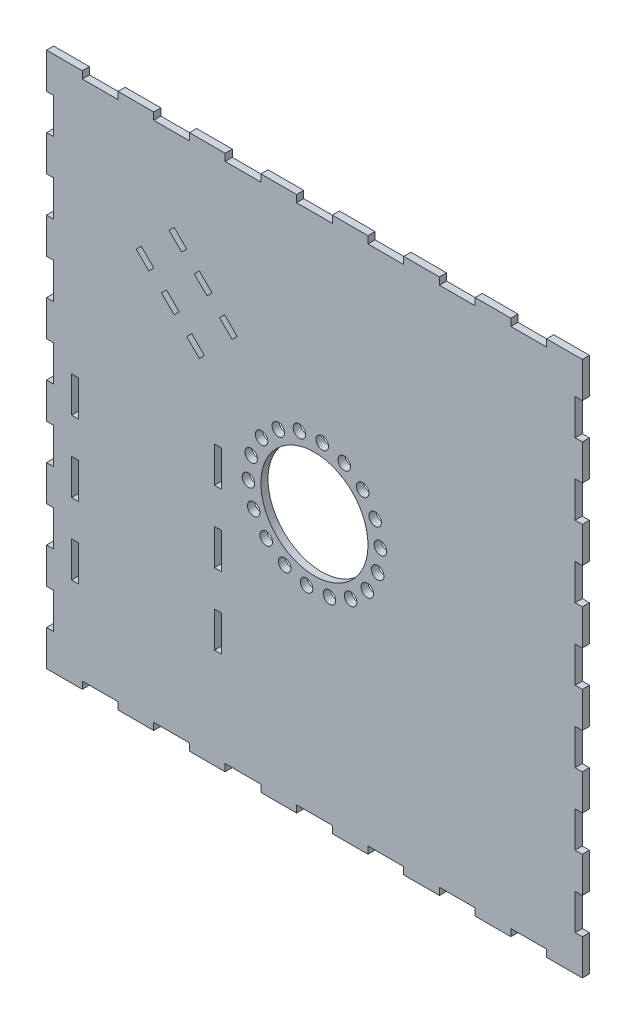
SolidWorks part; units mm, degrees
ref_plane "Front Plane" through (0, 0, 0) normal (0, 0, 1) x (1, 0, 0)
ref_plane "Top Plane" through (0, 0, 0) normal (0, 1, 0) x (1, 0, 0)
ref_plane "Right Plane" through (0, 0, 0) normal (1, 0, 0) x (0, 0, -1)
sketch "Sketch1" plane through (0, 0, 0) normal (0, 0, 1) x (1, 0, 0)
  line L1 (-75, -75) -> (75, -75)
  line L2 (-75, -75) -> (-75, 75)
  line L3 (-75, 75) -> (75, 75)
  line L4 (75, -75) -> (75, 75)
extrude "Boss-Extrude1" add sketch "Sketch1" against normal blind 2
other "Cavity1"
other "sideTop<2>@body1"
other "sideTop<1>@body1"
other "sideTop<3>@body1"
other "sideTop<4>@body1"
sketch "Sketch2" plane through (0, 0, -2) normal (0, 0, -1) x (-1, 0, 0)
  line L0 (75, 75) -> (-75, -75) construction
  line L1 (-75, 75) -> (75, -75) construction
  circle A1 centre (0, 0) radius 42.5 construction
  dimension "D1" = 85
sketch "Sketch3" plane through (0, 0, 0) normal (0, 0, 1) x (1, 0, 0)
  line L116 (-55, 75) -> (-55, 73)
  line L118 (-55, 75) -> (-55, 73)
  line L119 (-65, 75) -> (-75, 75)
  line L120 (-75, 75) -> (-75, 65)
  line L122 (-55, 73) -> (-65, 73)
  line L124 (-55, 73) -> (-65, 73)
  line L126 (-65, 73) -> (-65, 75)
  line L128 (-65, 73) -> (-65, 75)
  line L130 (-75, 65) -> (-73, 65)
  line L132 (-75, 65) -> (-73, 65)
  line L134 (-73, 65) -> (-73, 55)
  line L136 (-73, 65) -> (-73, 55)
  line L138 (-73, 55) -> (-75, 55)
  line L140 (-73, 55) -> (-75, 55)
  line L142 (-75, 55) -> (-75, 45)
  line L144 (-75, 55) -> (-75, 45)
  line L146 (-75, 45) -> (-73, 45)
  line L148 (-75, 45) -> (-73, 45)
  line L149 (-75, -75) -> (-65, -75)
  line L151 (-73, 45) -> (-73, 35)
  line L153 (-73, 45) -> (-73, 35)
  line L155 (-73, 35) -> (-75, 35)
  line L157 (-73, 35) -> (-75, 35)
  line L159 (-75, 35) -> (-75, 25)
  line L161 (-75, 35) -> (-75, 25)
  line L163 (-75, 25) -> (-73, 25)
  line L165 (-75, 25) -> (-73, 25)
  line L167 (-73, 25) -> (-73, 15)
  line L169 (-73, 25) -> (-73, 15)
  line L171 (-73, 15) -> (-75, 15)
  line L173 (-73, 15) -> (-75, 15)
  line L175 (-75, 15) -> (-75, 5)
  line L177 (-75, 15) -> (-75, 5)
  line L178 (75, -75) -> (75, -65)
  line L180 (-75, 5) -> (-73, 5)
  line L182 (-75, 5) -> (-73, 5)
  line L184 (-73, 5) -> (-73, -5)
  line L186 (-73, 5) -> (-73, -5)
  line L188 (-73, -5) -> (-75, -5)
  line L190 (-73, -5) -> (-75, -5)
  line L192 (-75, -5) -> (-75, -15)
  line L194 (-75, -5) -> (-75, -15)
  line L196 (-75, -15) -> (-73, -15)
  line L198 (-75, -15) -> (-73, -15)
  line L200 (-73, -15) -> (-73, -25)
  line L202 (-73, -15) -> (-73, -25)
  line L204 (-73, -25) -> (-75, -25)
  line L206 (-73, -25) -> (-75, -25)
  line L208 (-75, -25) -> (-75, -35)
  line L210 (-75, -25) -> (-75, -35)
  line L212 (-75, -35) -> (-73, -35)
  line L214 (-75, -35) -> (-73, -35)
  line L216 (-73, -35) -> (-73, -45)
  line L218 (-73, -35) -> (-73, -45)
  line L220 (-73, -45) -> (-75, -45)
  line L222 (-73, -45) -> (-75, -45)
  line L224 (-75, -45) -> (-75, -55)
  line L226 (-75, -45) -> (-75, -55)
  line L228 (-75, -55) -> (-73, -55)
  line L230 (-75, -55) -> (-73, -55)
  line L235 (-65, 75) -> (-75, 75)
  line L236 (-75, 75) -> (-75, 65)
  line L265 (-75, -75) -> (-65, -75)
  line L294 (75, -75) -> (75, -65)
  line L348 (-73, -55) -> (-73, -65)
  line L350 (-73, -55) -> (-73, -65)
  line L352 (-73, -65) -> (-75, -65)
  line L354 (-73, -65) -> (-75, -65)
  line L356 (-75, -65) -> (-75, -75)
  line L358 (-75, -65) -> (-75, -75)
  line L360 (-65, -75) -> (-65, -73)
  line L362 (-65, -75) -> (-65, -73)
  line L364 (-65, -73) -> (-55, -73)
  line L366 (-65, -73) -> (-55, -73)
  line L368 (-55, -73) -> (-55, -75)
  line L370 (-55, -73) -> (-55, -75)
  line L372 (-55, -75) -> (-45, -75)
  line L374 (-55, -75) -> (-45, -75)
  line L376 (-45, -75) -> (-45, -73)
  line L378 (-45, -75) -> (-45, -73)
  line L380 (-45, -73) -> (-35, -73)
  line L382 (-45, -73) -> (-35, -73)
  line L384 (-35, -73) -> (-35, -75)
  line L386 (-35, -73) -> (-35, -75)
  line L388 (-35, -75) -> (-25, -75)
  line L390 (-35, -75) -> (-25, -75)
  line L392 (-25, -75) -> (-25, -73)
  line L394 (-25, -75) -> (-25, -73)
  line L396 (-25, -73) -> (-15, -73)
  line L398 (-25, -73) -> (-15, -73)
  line L400 (-15, -73) -> (-15, -75)
  line L402 (-15, -73) -> (-15, -75)
  line L404 (-15, -75) -> (-5, -75)
  line L406 (-15, -75) -> (-5, -75)
  line L408 (-5, -75) -> (-5, -73)
  line L410 (-5, -75) -> (-5, -73)
  line L412 (-5, -73) -> (5, -73)
  line L414 (-5, -73) -> (5, -73)
  line L416 (5, -73) -> (5, -75)
  line L418 (5, -73) -> (5, -75)
  line L420 (5, -75) -> (15, -75)
  line L422 (5, -75) -> (15, -75)
  line L424 (15, -75) -> (15, -73)
  line L426 (15, -75) -> (15, -73)
  line L428 (15, -73) -> (25, -73)
  line L430 (15, -73) -> (25, -73)
  line L432 (25, -73) -> (25, -75)
  line L434 (25, -73) -> (25, -75)
  line L436 (25, -75) -> (35, -75)
  line L438 (25, -75) -> (35, -75)
  line L440 (35, -75) -> (35, -73)
  line L442 (35, -75) -> (35, -73)
  line L444 (35, -73) -> (45, -73)
  line L446 (35, -73) -> (45, -73)
  line L448 (45, -73) -> (45, -75)
  line L450 (45, -73) -> (45, -75)
  line L452 (45, -75) -> (55, -75)
  line L454 (45, -75) -> (55, -75)
  line L456 (55, -75) -> (55, -73)
  line L458 (55, -75) -> (55, -73)
  line L460 (55, -73) -> (65, -73)
  line L461 (55, -73) -> (65, -73)
  line L462 (65, -73) -> (65, -75)
  line L463 (65, -73) -> (65, -75)
  line L464 (65, -75) -> (75, -75)
  line L465 (65, -75) -> (75, -75)
  line L466 (75, -65) -> (73, -65)
  line L467 (75, -65) -> (73, -65)
  line L468 (73, -65) -> (73, -55)
  line L469 (73, -65) -> (73, -55)
  line L470 (73, -55) -> (75, -55)
  line L471 (73, -55) -> (75, -55)
  line L472 (75, -55) -> (75, -45)
  line L473 (75, -55) -> (75, -45)
  line L474 (75, -45) -> (73, -45)
  line L475 (75, -45) -> (73, -45)
  line L476 (73, -45) -> (73, -35)
  line L477 (73, -45) -> (73, -35)
  line L478 (73, -35) -> (75, -35)
  line L479 (73, -35) -> (75, -35)
  line L480 (75, -35) -> (75, -25)
  line L481 (75, -35) -> (75, -25)
  line L482 (75, -25) -> (73, -25)
  line L483 (75, -25) -> (73, -25)
  line L484 (73, -25) -> (73, -15)
  line L485 (73, -25) -> (73, -15)
  line L486 (73, -15) -> (75, -15)
  line L487 (73, -15) -> (75, -15)
  line L488 (75, -15) -> (75, -5)
  line L489 (75, -15) -> (75, -5)
  line L490 (75, -5) -> (73, -5)
  line L491 (75, -5) -> (73, -5)
  line L492 (73, -5) -> (73, 5)
  line L493 (73, -5) -> (73, 5)
  line L494 (73, 5) -> (75, 5)
  line L495 (73, 5) -> (75, 5)
  line L496 (75, 5) -> (75, 15)
  line L497 (75, 5) -> (75, 15)
  line L498 (75, 15) -> (73, 15)
  line L499 (75, 15) -> (73, 15)
  line L500 (73, 15) -> (73, 25)
  line L501 (73, 15) -> (73, 25)
  line L502 (73, 25) -> (75, 25)
  line L503 (73, 25) -> (75, 25)
  line L504 (75, 25) -> (75, 35)
  line L505 (75, 25) -> (75, 35)
  line L506 (75, 35) -> (73, 35)
  line L507 (75, 35) -> (73, 35)
  line L508 (73, 35) -> (73, 45)
  line L509 (73, 35) -> (73, 45)
  line L510 (73, 45) -> (75, 45)
  line L511 (73, 45) -> (75, 45)
  line L512 (75, 45) -> (75, 55)
  line L513 (75, 45) -> (75, 55)
  line L514 (75, 55) -> (73, 55)
  line L515 (75, 55) -> (73, 55)
  line L516 (73, 55) -> (73, 65)
  line L517 (73, 55) -> (73, 65)
  line L518 (73, 65) -> (75, 65)
  line L519 (73, 65) -> (75, 65)
  line L520 (75, 65) -> (75, 75)
  line L521 (75, 65) -> (75, 75)
  line L522 (75, 75) -> (65, 75)
  line L523 (75, 75) -> (65, 75)
  line L524 (65, 75) -> (65, 73)
  line L525 (65, 75) -> (65, 73)
  line L526 (65, 73) -> (55, 73)
  line L527 (65, 73) -> (55, 73)
  line L528 (55, 73) -> (55, 75)
  line L529 (55, 73) -> (55, 75)
  line L530 (55, 75) -> (45, 75)
  line L531 (55, 75) -> (45, 75)
  line L532 (45, 75) -> (45, 73)
  line L533 (45, 75) -> (45, 73)
  line L534 (45, 73) -> (35, 73)
  line L535 (45, 73) -> (35, 73)
  line L536 (35, 73) -> (35, 75)
  line L537 (35, 73) -> (35, 75)
  line L538 (35, 75) -> (25, 75)
  line L539 (35, 75) -> (25, 75)
  line L540 (25, 75) -> (25, 73)
  line L541 (25, 75) -> (25, 73)
  line L542 (25, 73) -> (15, 73)
  line L543 (25, 73) -> (15, 73)
  line L544 (15, 73) -> (15, 75)
  line L545 (15, 73) -> (15, 75)
  line L546 (15, 75) -> (5, 75)
  line L547 (15, 75) -> (5, 75)
  line L548 (5, 75) -> (5, 73)
  line L549 (5, 75) -> (5, 73)
  line L550 (5, 73) -> (-5, 73)
  line L551 (5, 73) -> (-5, 73)
  line L552 (-5, 73) -> (-5, 75)
  line L553 (-5, 73) -> (-5, 75)
  line L554 (-5, 75) -> (-15, 75)
  line L555 (-5, 75) -> (-15, 75)
  line L556 (-15, 75) -> (-15, 73)
  line L557 (-15, 75) -> (-15, 73)
  line L558 (-15, 73) -> (-25, 73)
  line L559 (-15, 73) -> (-25, 73)
  line L560 (-25, 73) -> (-25, 75)
  line L561 (-25, 73) -> (-25, 75)
  line L562 (-25, 75) -> (-35, 75)
  line L563 (-25, 75) -> (-35, 75)
  line L564 (-35, 75) -> (-35, 73)
  line L565 (-35, 75) -> (-35, 73)
  line L566 (-35, 73) -> (-45, 73)
  line L567 (-35, 73) -> (-45, 73)
  line L568 (-45, 73) -> (-45, 75)
  line L569 (-45, 73) -> (-45, 75)
  line L570 (-45, 75) -> (-55, 75)
  line L571 (-45, 75) -> (-55, 75)
  circle A0 centre (0, 0) radius 15 construction
  circle A1 centre (0, 0) radius 15
  dimension "D1" = 0
extrude "Cut-Extrude2" cut sketch "Sketch3" against normal blind 2 contours A1
sketch "Sketch4" plane through (0, 0, -2) normal (0, 0, -1) x (-1, 0, 0)
  line L116 (65, 75) -> (65, 73)
  line L117 (65, 75) -> (65, 73)
  line L118 (65, 73) -> (55, 73)
  line L119 (65, 73) -> (55, 73)
  line L120 (55, 73) -> (55, 75)
  line L121 (55, 73) -> (55, 75)
  line L122 (45, 75) -> (45, 73)
  line L123 (45, 75) -> (45, 73)
  line L124 (45, 73) -> (35, 73)
  line L125 (45, 73) -> (35, 73)
  line L126 (35, 73) -> (35, 75)
  line L127 (35, 73) -> (35, 75)
  line L128 (35, 75) -> (25, 75)
  line L129 (35, 75) -> (25, 75)
  line L130 (25, 75) -> (25, 73)
  line L131 (25, 75) -> (25, 73)
  line L132 (25, 73) -> (15, 73)
  line L133 (25, 73) -> (15, 73)
  line L134 (15, 73) -> (15, 75)
  line L135 (15, 73) -> (15, 75)
  line L136 (15, 75) -> (5, 75)
  line L137 (15, 75) -> (5, 75)
  line L138 (5, 75) -> (5, 73)
  line L139 (5, 75) -> (5, 73)
  line L140 (5, 73) -> (-5, 73)
  line L141 (5, 73) -> (-5, 73)
  line L142 (-5, 73) -> (-5, 75)
  line L143 (-5, 73) -> (-5, 75)
  line L144 (-5, 75) -> (-15, 75)
  line L145 (-5, 75) -> (-15, 75)
  line L146 (-15, 75) -> (-15, 73)
  line L147 (-15, 75) -> (-15, 73)
  line L148 (-15, 73) -> (-25, 73)
  line L149 (-15, 73) -> (-25, 73)
  line L150 (-25, 73) -> (-25, 75)
  line L151 (-25, 73) -> (-25, 75)
  line L152 (-25, 75) -> (-35, 75)
  line L153 (-25, 75) -> (-35, 75)
  line L154 (-35, 75) -> (-35, 73)
  line L155 (-35, 75) -> (-35, 73)
  line L156 (-35, 73) -> (-45, 73)
  line L157 (-35, 73) -> (-45, 73)
  line L158 (-45, 73) -> (-45, 75)
  line L159 (-45, 73) -> (-45, 75)
  line L160 (-45, 75) -> (-55, 75)
  line L161 (-45, 75) -> (-55, 75)
  line L162 (-55, 75) -> (-55, 73)
  line L163 (-55, 75) -> (-55, 73)
  line L164 (-55, 73) -> (-65, 73)
  line L165 (-55, 73) -> (-65, 73)
  line L166 (-65, 73) -> (-65, 75)
  line L167 (-65, 73) -> (-65, 75)
  line L168 (-65, 75) -> (-75, 75)
  line L169 (-65, 75) -> (-75, 75)
  line L170 (-75, 65) -> (-73, 65)
  line L171 (-75, 65) -> (-73, 65)
  line L172 (-73, 65) -> (-73, 55)
  line L173 (-73, 65) -> (-73, 55)
  line L174 (-73, 55) -> (-75, 55)
  line L175 (-73, 55) -> (-75, 55)
  line L176 (-75, 55) -> (-75, 45)
  line L177 (-75, 55) -> (-75, 45)
  line L178 (-75, 45) -> (-73, 45)
  line L179 (-75, 45) -> (-73, 45)
  line L180 (-73, 45) -> (-73, 35)
  line L181 (-73, 45) -> (-73, 35)
  line L182 (-73, 35) -> (-75, 35)
  line L183 (-73, 35) -> (-75, 35)
  line L184 (-75, 35) -> (-75, 25)
  line L185 (-75, 35) -> (-75, 25)
  line L186 (-75, 25) -> (-73, 25)
  line L187 (-75, 25) -> (-73, 25)
  line L188 (-73, 25) -> (-73, 15)
  line L189 (-73, 25) -> (-73, 15)
  line L190 (-73, 15) -> (-75, 15)
  line L191 (-73, 15) -> (-75, 15)
  line L192 (-75, 15) -> (-75, 5)
  line L193 (-75, 15) -> (-75, 5)
  line L194 (-75, 5) -> (-73, 5)
  line L195 (-75, 5) -> (-73, 5)
  line L196 (-73, 5) -> (-73, -5)
  line L197 (-73, 5) -> (-73, -5)
  line L198 (-73, -5) -> (-75, -5)
  line L199 (-73, -5) -> (-75, -5)
  line L200 (-75, -5) -> (-75, -15)
  line L201 (-75, -5) -> (-75, -15)
  line L202 (-75, -15) -> (-73, -15)
  line L203 (-75, -15) -> (-73, -15)
  line L204 (-73, -15) -> (-73, -25)
  line L205 (-73, -15) -> (-73, -25)
  line L206 (-73, -25) -> (-75, -25)
  line L207 (-73, -25) -> (-75, -25)
  line L208 (-75, -25) -> (-75, -35)
  line L209 (-75, -25) -> (-75, -35)
  line L210 (-75, -35) -> (-73, -35)
  line L211 (-75, -35) -> (-73, -35)
  line L212 (-73, -35) -> (-73, -45)
  line L213 (-73, -35) -> (-73, -45)
  line L214 (-73, -45) -> (-75, -45)
  line L215 (-73, -45) -> (-75, -45)
  line L216 (-75, -45) -> (-75, -55)
  line L217 (-75, -45) -> (-75, -55)
  line L218 (-75, -55) -> (-73, -55)
  line L219 (-75, -55) -> (-73, -55)
  line L220 (-73, -55) -> (-73, -65)
  line L221 (-73, -55) -> (-73, -65)
  line L222 (-73, -65) -> (-75, -65)
  line L223 (-73, -65) -> (-75, -65)
  line L224 (-75, -65) -> (-75, -75)
  line L225 (-75, -65) -> (-75, -75)
  line L226 (-65, -75) -> (-65, -73)
  line L227 (-65, -75) -> (-65, -73)
  line L228 (-65, -73) -> (-55, -73)
  line L229 (-65, -73) -> (-55, -73)
  line L230 (-55, -73) -> (-55, -75)
  line L231 (-55, -73) -> (-55, -75)
  line L348 (-55, -75) -> (-45, -75)
  line L350 (-55, -75) -> (-45, -75)
  line L352 (-45, -75) -> (-45, -73)
  line L356 (55, 75) -> (45, 75)
  line L357 (55, 75) -> (45, 75)
  line L358 (-45, -75) -> (-45, -73)
  line L362 (-45, -73) -> (-35, -73)
  line L366 (-45, -73) -> (-35, -73)
  line L370 (-35, -73) -> (-35, -75)
  line L374 (-35, -73) -> (-35, -75)
  line L378 (-35, -75) -> (-25, -75)
  line L382 (-35, -75) -> (-25, -75)
  line L386 (-25, -75) -> (-25, -73)
  line L390 (-25, -75) -> (-25, -73)
  line L394 (-25, -73) -> (-15, -73)
  line L398 (-25, -73) -> (-15, -73)
  line L402 (-15, -73) -> (-15, -75)
  line L406 (-75, 75) -> (-75, 65)
  line L407 (-75, 75) -> (-75, 65)
  line L408 (-15, -73) -> (-15, -75)
  line L412 (-15, -75) -> (-5, -75)
  line L416 (-15, -75) -> (-5, -75)
  line L420 (-5, -75) -> (-5, -73)
  line L424 (-5, -75) -> (-5, -73)
  line L428 (-5, -73) -> (5, -73)
  line L432 (-5, -73) -> (5, -73)
  line L436 (5, -73) -> (5, -75)
  line L440 (5, -73) -> (5, -75)
  line L444 (5, -75) -> (15, -75)
  line L448 (5, -75) -> (15, -75)
  line L452 (15, -75) -> (15, -73)
  line L456 (15, -75) -> (15, -73)
  line L460 (15, -73) -> (25, -73)
  line L462 (-75, -75) -> (-65, -75)
  line L463 (-75, -75) -> (-65, -75)
  line L466 (15, -73) -> (25, -73)
  line L470 (25, -73) -> (25, -75)
  line L474 (25, -73) -> (25, -75)
  line L478 (25, -75) -> (35, -75)
  line L482 (25, -75) -> (35, -75)
  line L486 (35, -75) -> (35, -73)
  line L490 (35, -75) -> (35, -73)
  line L494 (35, -73) -> (45, -73)
  line L498 (35, -73) -> (45, -73)
  line L502 (45, -73) -> (45, -75)
  line L506 (45, -73) -> (45, -75)
  line L510 (45, -75) -> (55, -75)
  line L514 (45, -75) -> (55, -75)
  line L518 (75, -75) -> (75, -65)
  line L519 (75, -75) -> (75, -65)
  line L520 (55, -75) -> (55, -73)
  line L524 (55, -75) -> (55, -73)
  line L528 (55, -73) -> (65, -73)
  line L532 (55, -73) -> (65, -73)
  line L536 (65, -73) -> (65, -75)
  line L540 (65, -73) -> (65, -75)
  line L544 (65, -75) -> (75, -75)
  line L548 (65, -75) -> (75, -75)
  line L552 (75, -65) -> (73, -65)
  line L556 (75, -65) -> (73, -65)
  line L560 (73, -65) -> (73, -55)
  line L564 (73, -65) -> (73, -55)
  line L568 (73, -55) -> (75, -55)
  line L572 (73, -55) -> (75, -55)
  line L576 (75, -55) -> (75, -45)
  line L578 (75, -55) -> (75, -45)
  line L580 (75, -45) -> (73, -45)
  line L582 (75, -45) -> (73, -45)
  line L584 (73, -45) -> (73, -35)
  line L586 (73, -45) -> (73, -35)
  line L588 (73, -35) -> (75, -35)
  line L590 (73, -35) -> (75, -35)
  line L592 (75, -35) -> (75, -25)
  line L594 (75, -35) -> (75, -25)
  line L596 (75, -25) -> (73, -25)
  line L598 (75, -25) -> (73, -25)
  line L600 (73, -25) -> (73, -15)
  line L602 (73, -25) -> (73, -15)
  line L604 (73, -15) -> (75, -15)
  line L606 (73, -15) -> (75, -15)
  line L608 (75, -15) -> (75, -5)
  line L610 (75, -15) -> (75, -5)
  line L612 (75, -5) -> (73, -5)
  line L614 (75, -5) -> (73, -5)
  line L616 (73, -5) -> (73, 5)
  line L618 (73, -5) -> (73, 5)
  line L620 (73, 5) -> (75, 5)
  line L622 (73, 5) -> (75, 5)
  line L624 (75, 5) -> (75, 15)
  line L626 (75, 5) -> (75, 15)
  line L628 (75, 15) -> (73, 15)
  line L630 (75, 15) -> (73, 15)
  line L632 (73, 15) -> (73, 25)
  line L634 (73, 15) -> (73, 25)
  line L636 (73, 25) -> (75, 25)
  line L638 (73, 25) -> (75, 25)
  line L640 (75, 25) -> (75, 35)
  line L642 (75, 25) -> (75, 35)
  line L644 (75, 35) -> (73, 35)
  line L646 (75, 35) -> (73, 35)
  line L648 (73, 35) -> (73, 45)
  line L650 (73, 35) -> (73, 45)
  line L652 (73, 45) -> (75, 45)
  line L654 (73, 45) -> (75, 45)
  line L656 (75, 45) -> (75, 55)
  line L658 (75, 45) -> (75, 55)
  line L660 (75, 55) -> (73, 55)
  line L662 (75, 55) -> (73, 55)
  line L664 (73, 55) -> (73, 65)
  line L666 (73, 55) -> (73, 65)
  line L668 (73, 65) -> (75, 65)
  line L670 (73, 65) -> (75, 65)
  line L672 (75, 65) -> (75, 75)
  line L674 (75, 65) -> (75, 75)
  line L676 (75, 75) -> (65, 75)
  line L678 (75, 75) -> (65, 75)
  circle A0 centre (17.7065, 5.3602) radius 1.75 construction
  circle A1 centre (4.2112, 18.0143) radius 1.75 construction
  circle A2 centre (10.1185, 15.4876) radius 1.75 construction
  circle A3 centre (17.7065, 5.3602) radius 1.75
  circle A4 centre (4.2112, 18.0143) radius 1.75
  circle A5 centre (10.1185, 15.4876) radius 1.75
  circle A6 centre (18.4719, -1.019) radius 1.75 construction
  circle A7 centre (-2.2041, 18.3682) radius 1.75 construction
  circle A8 centre (14.8053, 11.0929) radius 1.75 construction
  circle A9 centre (18.4719, -1.019) radius 1.75
  circle A10 centre (-2.2041, 18.3682) radius 1.75
  circle A11 centre (14.8053, 11.0929) radius 1.75
  circle A12 centre (-17.0094, 7.2753) radius 1.75 construction
  circle A13 centre (-13.4953, 12.6541) radius 1.75 construction
  circle A14 centre (-8.3534, 16.5067) radius 1.75 construction
  circle A15 centre (-17.0094, 7.2753) radius 1.75
  circle A16 centre (-13.4953, 12.6541) radius 1.75
  circle A17 centre (-8.3534, 16.5067) radius 1.75
  circle A18 centre (-14.8053, -11.0929) radius 1.75 construction
  circle A19 centre (-17.7065, -5.3602) radius 1.75 construction
  circle A20 centre (-18.4719, 1.019) radius 1.75 construction
  circle A21 centre (-14.8053, -11.0929) radius 1.75
  circle A22 centre (-17.7065, -5.3602) radius 1.75
  circle A23 centre (-18.4719, 1.019) radius 1.75
  circle A24 centre (8.3534, -16.5067) radius 1.75 construction
  circle A25 centre (13.4953, -12.6541) radius 1.75 construction
  circle A26 centre (17.0094, -7.2753) radius 1.75 construction
  circle A27 centre (8.3534, -16.5067) radius 1.75
  circle A28 centre (13.4953, -12.6541) radius 1.75
  circle A29 centre (17.0094, -7.2753) radius 1.75
  circle A30 centre (-10.1185, -15.4876) radius 1.75 construction
  circle A31 centre (-4.2112, -18.0143) radius 1.75 construction
  circle A32 centre (2.2041, -18.3682) radius 1.75 construction
  circle A33 centre (2.2041, -18.3682) radius 1.75
  circle A34 centre (-4.2112, -18.0143) radius 1.75
  circle A35 centre (-10.1185, -15.4876) radius 1.75
  dimension "D1" = 0
extrude "Cut-Extrude3" cut sketch "Sketch4" against normal blind 2 contours A4 | A5 | A3 | A15 | A16 | A17 | A10 | A11 | A9 | A27 | A21 | A22 | A23 | A28 | A33 | A34 | A35 | A29
other "Cavity2"
other "servoFitSide<1>@body1"
other "servoFitSide<2>@body1"
other "Cavity4"
other "batteryPackNCase<1>@body/batteryCoverSide<2>@batteryPackNCase2"
other "batteryPackNCase<1>@body/batteryCoverSide<1>@batteryPackNCase2"
equation "\"anch\" = 2"
equation "\"alt\" = 100"
equation "\"pilanch\" = 100"
equation "\"pilalt\" = 250"
equation "\"bodyHeigh\" = 60"
equation "\"dorsalFinHeigh\" = 400"
